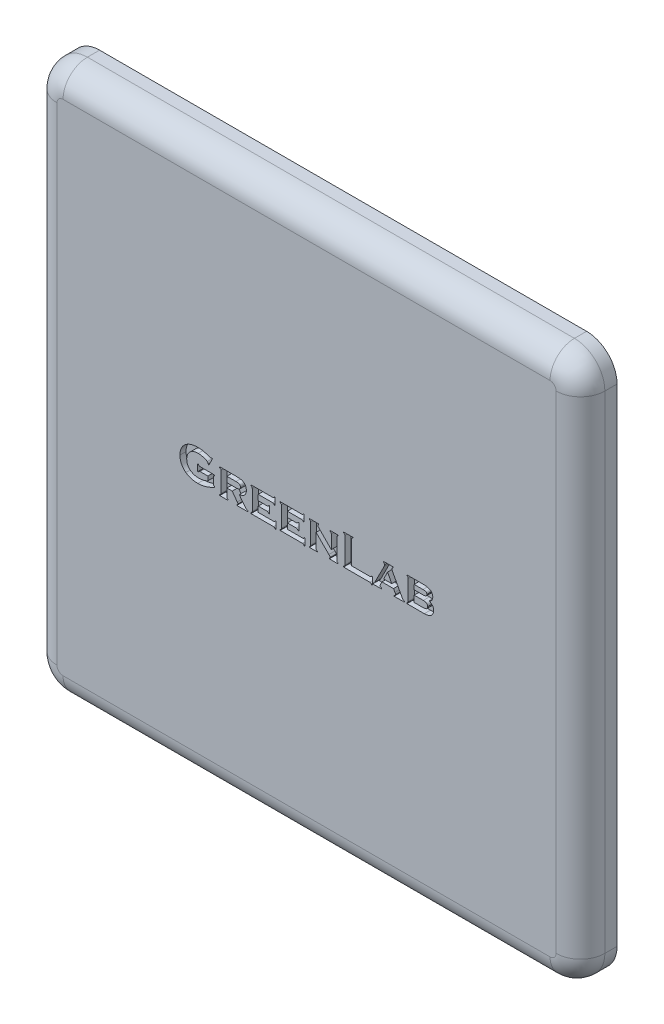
SolidWorks part; units mm, degrees
ref_plane "Front Plane" through (0, 0, 0) normal (0, 0, 1) x (1, 0, 0)
ref_plane "Top Plane" through (0, 0, 0) normal (0, 1, 0) x (1, 0, 0)
ref_plane "Right Plane" through (0, 0, 0) normal (1, 0, 0) x (0, 0, -1)
ref_plane "Plane1" through (0, 0, 3) normal (0, 0, 1) x (1, 0, 0)
sketch "Sketch1" plane through (0, 0, 3) normal (0, 0, 1) x (1, 0, 0)
  line L0 (22.5, -22.5) -> (22.5, 22.5)
  line L1 (22.5, 22.5) -> (-22.5, 22.5)
  line L2 (-22.5, 22.5) -> (-22.5, -22.5)
  line L3 (-22.5, -22.5) -> (22.5, -22.5)
  dimension "D1" = 45
  dimension "D2" = 45
extrude "Boss-Extrude1" add sketch "Sketch1" against normal blind 3
fillet "Fillet1" radius 2.5 4 edges at (-22.5, 22.5, 1.5) (22.5, 22.5, 1.5) (-22.5, -22.5, 1.5) (22.5, -22.5, 1.5)
fillet "Fillet2" radius 2 8 edges at (-21.7678, -21.7678, 3) (-22.5, 0, 3) (0, -22.5, 3) (-21.7678, 21.7678, 3) (21.7678, -21.7678, 3) (0, 22.5, 3) (22.5, 0, 3) (21.7678, 21.7678, 3)
sketch "Sketch2" plane through (0, 0, 3) normal (0, 0, 1) x (1, 0, 0)
  line L0 (-20.5, -1.25) -> (20.5, -1.25) construction
  line L1 (-20.5, 20) -> (-20.5, -20) construction
  line L2 (20.5, -20) -> (20.5, 20) construction
  line L3 (20, -22.5) -> (-20, -22.5) construction
  text T0 "GreenLab" font "Copperplate Gothic Bold" height 2.5
  dimension "D1" = 21.25
extrude "Cut-Extrude1" cut sketch "Sketch2" against normal blind 0.5
